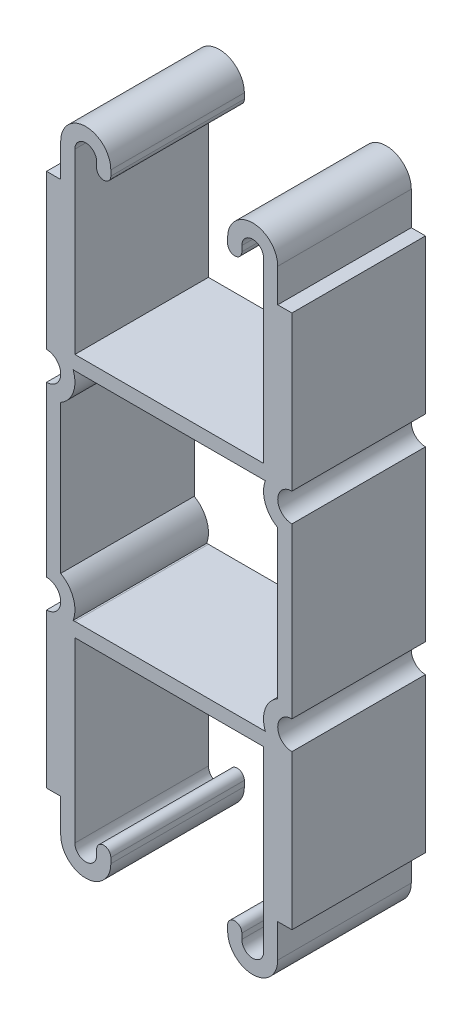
SolidWorks part; units mm, degrees
ref_plane "Plane1" through (0, 0, 0) normal (0, 0, 1) x (1, 0, 0)
ref_plane "Plane2" through (0, 0, 0) normal (0, 1, 0) x (1, 0, 0)
ref_plane "Plane3" through (0, 0, 0) normal (1, 0, 0) x (0, 0, -1)
sketch "Sketch1" plane through (0, 33.02, 0) normal (0, 0, 1) x (1, 0, 0)
  line L0 (-20.6375, 24.13) -> (-20.6375, -9.6901)
  line L1 (-17.9451, -12.3825) -> (17.9451, -12.3825)
  line L2 (20.6375, -9.6901) -> (20.6375, 24.13)
  line L3 (11.1125, 24.13) -> (11.1125, 23.095)
  line L4 (-11.1125, 24.13) -> (-11.1125, 23.095)
  line L5 (-13.8049, 24.13) -> (-13.8049, 23.095)
  line L6 (-17.9451, 24.13) -> (-17.9451, -9.6901)
  line L7 (-17.9451, -9.6901) -> (17.9451, -9.6901)
  line L8 (17.9451, -9.6901) -> (17.9451, 24.13)
  line L9 (13.8049, 24.13) -> (13.8049, 23.095)
  line L10 (-25.4, 28.8925) -> (25.4, 28.8925) construction
  line L11 (-12.8524, 21.7488) -> (12.8524, 21.7488) construction
  arc A0 (20.6375, 24.13) -> (11.1125, 24.13) centre (15.875, 24.13) ccw
  arc A1 (-20.6375, 24.13) -> (-11.1125, 24.13) centre (-15.875, 24.13) cw
  arc A2 (-17.9451, -12.3825) -> (-20.6375, -9.6901) centre (-17.9451, -9.6901) cw
  arc A3 (17.9451, -12.3825) -> (20.6375, -9.6901) centre (17.9451, -9.6901) ccw
  arc A4 (-17.9451, 24.13) -> (-13.8049, 24.13) centre (-15.875, 24.13) cw
  arc A5 (17.9451, 24.13) -> (13.8049, 24.13) centre (15.875, 24.13) ccw
  arc A6 (11.1125, 23.095) -> (13.8049, 23.095) centre (12.4587, 23.095) ccw
  arc A7 (-11.1125, 23.095) -> (-13.8049, 23.095) centre (-12.4587, 23.095) cw
  dimension "D1" = 2.6924
  dimension "D3" = 20.6375
  dimension "D4" = 20.6375
  dimension "Width" = 41.275
  dimension "D6" = 9.525
  dimension "D7" = 22.225
  dimension "D9" = 7.1437
  dimension "D2" = 41.275
  dimension "gauge" = 2.6924
extrude "Base-Extrude" add sketch "Sketch1" along normal mid plane 25.4
sketch "Sketch2" plane through (0, 0, 0) normal (0, 0, 1) x (1, 0, 0)
  line L0 (-23.3375, 50.8) -> (-23.3375, 21.4579)
  line L1 (-23.3375, 16.0579) -> (-23.3375, -16.0579)
  line L2 (-20.6375, 50.8) -> (-20.6375, 23.4344)
  line L3 (-20.6375, 14.0814) -> (-20.6375, -14.0814)
  line L5 (-23.3375, -21.4579) -> (-23.3375, -50.8)
  line L6 (-20.6375, -23.4344) -> (-20.6375, -50.8)
  line L7 (-23.3375, 50.8) -> (-20.6375, 50.8)
  line L8 (-23.3375, -50.8) -> (-20.6375, -50.8)
  arc A0 (-23.3375, 16.0579) -> (-23.3375, 21.4579) centre (-23.3375, 18.7579) ccw
  arc A1 (-20.6375, 14.0814) -> (-20.6375, 23.4344) centre (-23.3375, 18.7579) ccw
  arc A2 (-20.6375, -14.0814) -> (-20.6375, -23.4344) centre (-23.3375, -18.7579) cw
  arc A3 (-23.3375, -16.0579) -> (-23.3375, -21.4579) centre (-23.3375, -18.7579) cw
  dimension "D4" = 18.7579
  dimension "D3" = 2.7
  dimension "D9" = 5.4
  dimension "D1" = 20.6375
  dimension "D2" = 50.8
  dimension "gauge" = 2.7
  dimension "D6" = 101.6
  dimension "D11" = 37.5158
extrude "Boss-Extrude1" add sketch "Sketch2" along normal mid plane 25.4
mirror "Mirror1" about plane through (0, 0, 0) normal (0, 1, 0) of "Base-Extrude"
mirror "Mirror2" about plane through (0, 0, 0) normal (1, 0, 0) of "Boss-Extrude1"
equation "\"D3@Sketch1\" = \"Width@Sketch1\" / 2"
equation "\"D7@Sketch1\" = \"Width@Sketch1\" - 2 * \"D6@Sketch1\""
equation "\"D1@Sketch1\" = \"gauge@Sketch1\""
equation "\"D1@Boss-Extrude1\" = \"D1@Base-Extrude\""
